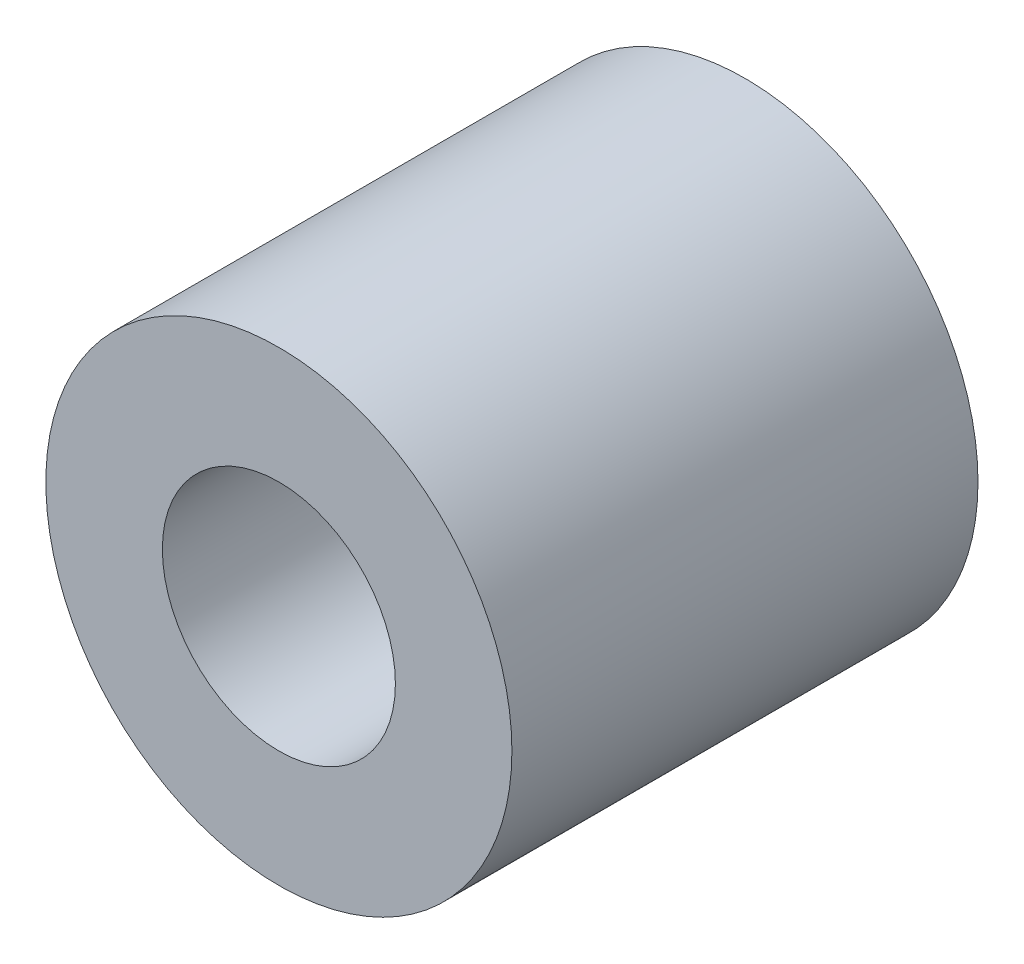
SolidWorks part; units mm, degrees
ref_plane "Front Plane" through (0, 0, 0) normal (0, 0, 1) x (1, 0, 0)
ref_plane "Top Plane" through (0, 0, 0) normal (0, 1, 0) x (1, 0, 0)
ref_plane "Right Plane" through (0, 0, 0) normal (1, 0, 0) x (0, 0, -1)
sketch "Sketch1" plane through (0, 0, 0) normal (0, 0, 1) x (1, 0, 0)
  circle A0 centre (0, 0) radius 3.175
  circle A1 centre (0, 0) radius 1.5875
extrude "Boss-Extrude1" add sketch "Sketch1" along normal mid plane 6.35
